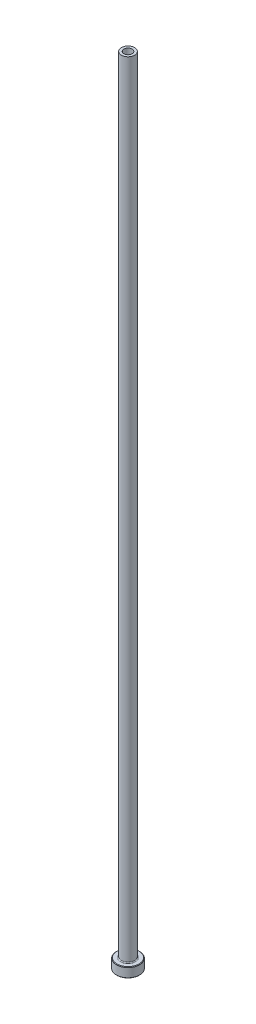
SolidWorks part; units mm, degrees
ref_plane "Front Plane" through (0, 0, 0) normal (0, 0, 1) x (1, 0, 0)
ref_plane "Top Plane" through (0, 0, 0) normal (0, 1, 0) x (1, 0, 0)
ref_plane "Right Plane" through (0, 0, 0) normal (1, 0, 0) x (0, 0, -1)
sketch "Sketch1" plane through (0, 0, 0) normal (0, 0, 1) x (1, 0, 0)
  line L0 (0, 0) -> (0, 50000) construction
  line L1 (0, 0) -> (5.5499, 0)
  line L2 (5.5499, 0) -> (5.5499, 4.7498)
  line L3 (5.5499, 4.7498) -> (3.5655, 4.7498)
  line L4 (3.1686, 5.1467) -> (3.1686, 381)
  line L5 (3.1686, 381) -> (0, 381)
  line L6 (0, 381) -> (0, 0)
  arc A0 (3.1686, 5.1467) -> (3.5655, 4.7498) centre (3.5655, 5.1467) ccw
  dimension "D5" = 0.3969
  dimension "D1" = 6.3373
  dimension "D2" = 11.0998
  dimension "D3" = 4.7498
  dimension "D4" = 381
revolve "Revolve1" add sketch "Sketch1" angle 360 about L0
sketch "Sketch2" plane through (0, 0, 0) normal (0, 0, 1) x (1, 0, 0)
  line L0 (0, 0) -> (0, 50000) construction
  line L1 (-5.5499, 0) -> (5.5499, 0) construction
  line L2 (2.5711, 0) -> (2.1742, 0.3969)
  line L3 (2.1742, 0.3969) -> (2.1742, 306.5145)
  line L4 (2.1742, 306.5145) -> (1.9837, 320.802)
  line L5 (1.9837, 320.802) -> (1.9837, 381)
  line L6 (3.1686, 381) -> (-3.1686, 381) construction
  line L7 (1.9837, 381) -> (0, 381)
  line L8 (0, 381) -> (0, 0)
  line L9 (0, 0) -> (2.5711, 0)
  point P4 (0, 0)
  dimension "D1" = 0.3969
  dimension "D2" = 45
  dimension "D3" = 3.9675
  dimension "D4" = 4.3485
  dimension "D5" = 60.198
  dimension "D6" = 14.2875
revolve "Cut-Revolve1" cut sketch "Sketch2" angle 360 about L0
chamfer "Chamfer1" distance 0.254 angle 45 2 edges at (0, 0, -5.5499) (0, 4.7498, -5.5499)
